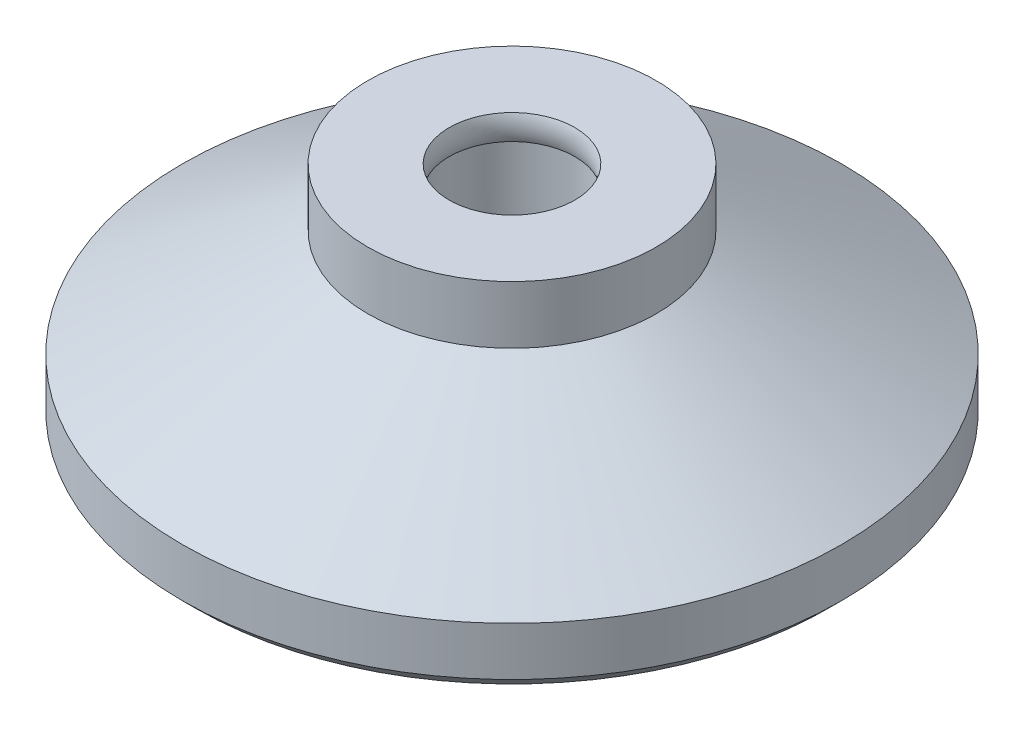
SolidWorks part; units mm, degrees
ref_plane "Front Plane" through (0, 0, 0) normal (0, 0, 1) x (1, 0, 0)
ref_plane "Top Plane" through (0, 0, 0) normal (0, 1, 0) x (1, 0, 0)
ref_plane "Right Plane" through (0, 0, 0) normal (1, 0, 0) x (0, 0, -1)
sketch "Sketch1" plane through (0, 0, 0) normal (0, 1, 0) x (1, 0, 0)
  circle A0 centre (0, 0) radius 7
  dimension "D1" = 14
extrude "Extrude1" add sketch "Sketch1" along normal mid plane 11
sketch "Sketch3" plane through (0, -5.5, 0) normal (0, -1, 0) x (1, 0, 0)
  circle A0 centre (0, 0) radius 16
  dimension "D1" = 32
extrude "Extrude2" add sketch "Sketch3" against normal blind 3
sketch "Sketch4" plane through (0, 0, 0) normal (0, 0, 1) x (1, 0, 0)
  line L0 (-16, -2.5) -> (-7, 2.6962)
  line L1 (-7, 5.5) -> (-7, -2.5) construction
  line L2 (-7, 2.6962) -> (-7, -2.5)
  line L3 (-7, -2.5) -> (-16, -2.5)
  dimension "D1" = 30
revolve "Revolve1" add sketch "Sketch4" angle 360 about axis through (0, 5.5, 0) along (0, -1, 0)
chamfer "Chamfer1" distance 0.64 angle 45 1 edges at (0, -5.5, -16)
sketch "Sketch5" plane through (0, 0, 0) normal (0, 0, 1) x (1, 0, 0)
  line L1 (0, 0) -> (0, 11.3083) construction
  line L2 (0, 5.5) -> (3.05, 5.5)
  line L3 (7, 5.5) -> (-7, 5.5) construction
  line L4 (3.05, 4.28) -> (3.05, -0.7391)
  line L5 (3.05, -0.7391) -> (0, -2.5)
  line L6 (0, -2.5) -> (0, 5.5)
  line L7 (16, -2.5) -> (-16, -2.5) construction
  arc A0 (3.05, 5.5) -> (3.05, 4.28) centre (4.514, 4.89) ccw
  point P14 (2.928, 4.89)
  dimension "D2" = 6.1
  dimension "D1" = 60
  dimension "D3" = 1.22
  dimension "D4" = 0.122
revolve "Cut-Revolve1" cut sketch "Sketch5" angle 360 about L1
equation "\"D3@Sketch5\" = \"D2@Sketch5\"*0.2"
equation "\"D4@Sketch5\" = \"D3@Sketch5\"*0.1"
